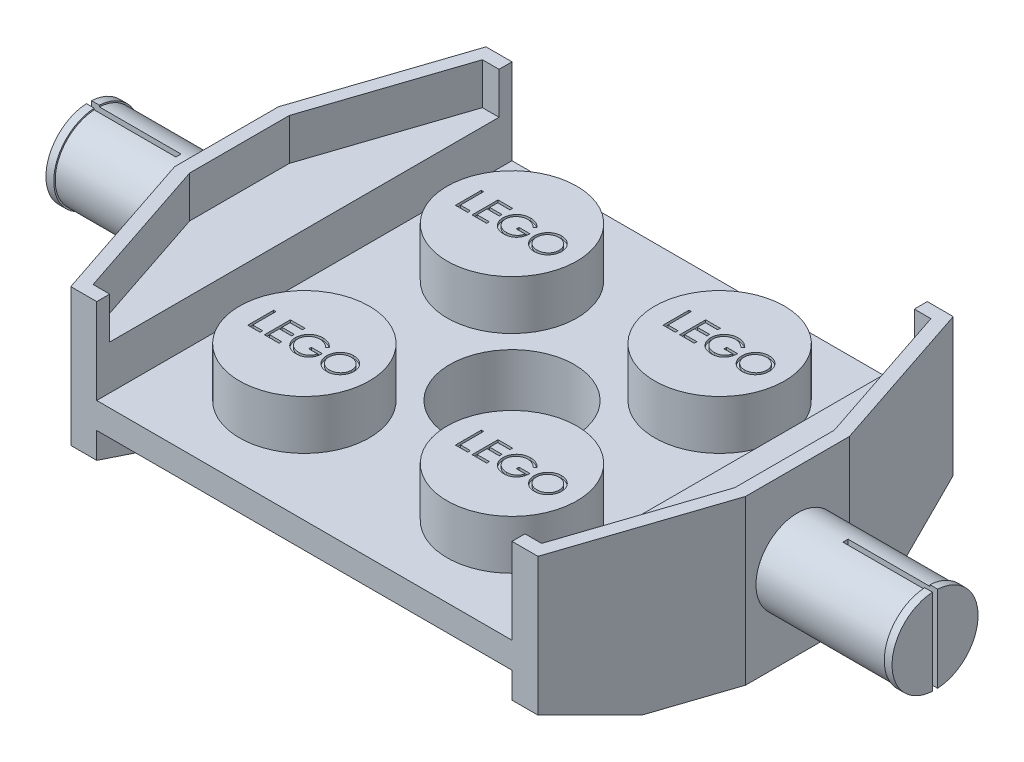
SolidWorks part; units mm, degrees
ref_plane "Plano frontal" through (0, 0, 0) normal (0, 0, 1) x (1, 0, 0)
ref_plane "Plano superior" through (0, 0, 0) normal (0, 1, 0) x (1, 0, 0)
ref_plane "Plano direito" through (0, 0, 0) normal (1, 0, 0) x (0, 0, -1)
sketch "Esboço1" plane through (0, 0, 0) normal (0, 1, 0) x (1, 0, 0)
  line L1 (0, 0) -> (16, 0)
  line L2 (0, 0) -> (0, 16)
  line L3 (0, 16) -> (16, 16)
  line L4 (16, 0) -> (16, 16)
  dimension "D1" = 16
  dimension "D2" = 16
extrude "Ressalto-extrusão1" add sketch "Esboço1" along normal blind 10
sketch "Esboço2" plane through (0, 10, 0) normal (0, 1, 0) x (1, 0, 0)
  line L0 (0, 0) -> (16, 0) construction
  line L1 (16, 0) -> (16, 16) construction
  circle A0 centre (4, 4) radius 2.5
  circle A1 centre (4, 12) radius 2.5
  circle A2 centre (12, 12) radius 2.5
  circle A3 centre (12, 4) radius 2.5
  dimension "D1" = 5
  dimension "D2" = 5
  dimension "D3" = 5
  dimension "D4" = 5
  dimension "D5" = 8
  dimension "D6" = 8
  dimension "D7" = 8
  dimension "D8" = 8
  dimension "D9" = 4
  dimension "D10" = 4
  dimension "D11" = 8
extrude "Ressalto-extrusão2" add sketch "Esboço2" along normal blind 1.9
sketch "Esboço3" plane through (0, 0, 0) normal (0, -1, 0) x (1, 0, 0)
  line L0 (0, 0) -> (16, 0) construction
  line L1 (1, -1) -> (15, -1)
  line L2 (1, -1) -> (1, -15)
  line L3 (1, -15) -> (15, -15)
  line L4 (15, -1) -> (15, -15)
  line L5 (16, -16) -> (0, -16) construction
  line L6 (16, 0) -> (16, -16) construction
  line L7 (0, -16) -> (0, 0) construction
  circle A0 centre (8, -8) radius 3.5
  circle A1 centre (8, -8) radius 2.5
  dimension "D5" = 7
  dimension "D6" = 5
  dimension "D1" = 1
  dimension "D2" = 1
  dimension "D3" = 1
  dimension "D4" = 1
extrude "Corte-extrusão1" cut sketch "Esboço3" against normal blind 9 contours L4 L1 L2 L3 A0 | A1
sketch "Esboço6" plane through (0, 11.9, 0) normal (0, 1, 0) x (1, 0, 0)
  text T0 "LEGO" font "Century Gothic" height 1
extrude "Corte-extrusão2" cut sketch "Esboço6" against normal blind 0.1
pattern_linear "Padrão linear1" count 2 spacing 8 along (0, 0, -1) of "Corte-extrusão2"
pattern_linear "Padrão linear2" count 2 spacing 8 along (1, 0, 0) of "Padrão linear1", "Corte-extrusão2"
pattern_linear "Padrão linear3" count 3 spacing 16 along (0, 0, -1) of "Ressalto-extrusão1", "Ressalto-extrusão2", "Corte-extrusão1", "Corte-extrusão2", "Padrão linear1", "Padrão linear2"
sketch "Esboço7" plane through (0, 0, 0) normal (0, -1, 0) x (1, 0, 0)
  line L1 (1, -15) -> (15, -15)
  line L2 (1, -15) -> (1, -17)
  line L3 (1, -17) -> (15, -17)
  line L4 (15, -15) -> (15, -17)
  line L5 (1, -31) -> (15, -31)
  line L6 (1, -31) -> (1, -33)
  line L7 (1, -33) -> (15, -33)
  line L8 (15, -31) -> (15, -33)
extrude "Corte-extrusão3" cut sketch "Esboço7" against normal up to surface (9 mm away)
sketch "Esboço8" plane through (16, 0, 0) normal (1, 0, 0) x (0, 0, -1)
  line L0 (48, 10) -> (48, 0) construction
  line L1 (0, 0) -> (48, 0)
  line L2 (0, 0) -> (0, 6.6666)
  line L3 (0, 6.6666) -> (48, 6.6666)
  line L4 (48, 0) -> (48, 6.6666)
  dimension "D1" = 6.6666
extrude "Corte-extrusão4" cut sketch "Esboço8" against normal blind 20
sketch "Esboço12" plane through (16, 0, 0) normal (1, 0, 0) x (0, 0, -1)
  line L0 (0, 10) -> (48, 10) construction
  line L1 (16, 10) -> (48, 10)
  line L2 (16, 10) -> (16, 6.6666)
  line L3 (16, 6.6666) -> (48, 6.6666)
  line L4 (48, 10) -> (48, 6.6666)
  line L5 (0, 10) -> (0, 6.6666) construction
  line L7 (16, 10) -> (48, 10)
  line L8 (16, 10) -> (16, 14.4178)
  line L9 (16, 14.4178) -> (48, 14.4178)
  line L10 (48, 10) -> (48, 14.4178)
  dimension "D1" = 16
extrude "Corte-extrusão7" cut sketch "Esboço12" against normal blind 20 contours L10 L9 L8 M6 | L2 M6 M4 M5
sketch "Esboço13" plane through (0, 9, 0) normal (0, -1, 0) x (1, 0, 0)
  line L0 (15, -1) -> (15, -16) construction
  line L1 (1, -16) -> (15, -16)
  line L2 (1, -16) -> (1, -15)
  line L3 (1, -15) -> (15, -15)
  line L4 (15, -16) -> (15, -15)
  dimension "D1" = 1
extrude "Ressalto-extrusão4" add sketch "Esboço13" along normal up to surface (2.3334 mm away)
sketch "Esboço14" plane through (0, 0, 0) normal (0, 0, 1) x (1, 0, 0)
  line L0 (0, 10) -> (16, 10) construction
  line L1 (16, 6.6666) -> (19, 6.6666)
  line L2 (16, 6.6666) -> (16, 13.3)
  line L3 (16, 13.3) -> (19, 13.3)
  line L4 (19, 6.6666) -> (19, 13.3)
  dimension "D1" = 3
  dimension "D2" = 3.3
extrude "Ressalto-extrusão5" add sketch "Esboço14" against normal up to surface (16 mm away)
sketch "Esboço15" plane through (0, 13.3, 0) normal (0, 1, 0) x (1, 0, 0)
  line L0 (17, 16) -> (19, 10)
  line L1 (19, 16) -> (16, 16) construction
  line L2 (19, 16) -> (19, 0) construction
  line L3 (19, 10) -> (19, 16)
  line L4 (19, 16) -> (17, 16)
  line L5 (17, 0) -> (19, 6)
  line L6 (19, 0) -> (16, 0) construction
  line L7 (19, 6) -> (19, 0)
  line L8 (19, 0) -> (17, 0)
  dimension "D1" = 6
  dimension "D2" = 1
  dimension "D3" = 1
  dimension "D4" = 6
extrude "Corte-extrusão8" cut sketch "Esboço15" against normal blind 10
sketch "Esboço17" plane through (0, 0, 0) normal (0, 0, 1) x (1, 0, 0)
  line L0 (0, 10) -> (0, 6.6666) construction
  line L1 (0, 9) -> (16, 9)
  line L2 (0, 9) -> (0, 6.6666)
  line L3 (0, 6.6666) -> (16, 6.6666)
  line L4 (16, 9) -> (16, 6.6666)
  line L5 (0, 6.6666) -> (17, 6.6666) construction
  dimension "D1" = 1
extrude "Corte-extrusão9" cut sketch "Esboço17" against normal blind 20
sketch "Esboço18" plane through (0, 0, 0) normal (0, 0, 1) x (1, 0, 0)
  line L0 (16, 9) -> (0, 9) construction
  line L1 (16, 6.6666) -> (23.2369, 6.6666)
  line L2 (16, 6.6666) -> (16, 7)
  line L3 (16, 7) -> (23.2369, 7)
  line L4 (23.2369, 6.6666) -> (23.2369, 7)
  dimension "D1" = 2
extrude "Corte-extrusão10" cut sketch "Esboço18" against normal blind 20
sketch "Esboço19" plane through (0, 13.3, 0) normal (0, 1, 0) x (1, 0, 0)
  line L10 (16.6396, 0.5) -> (16, 0.5)
  line L11 (18.5, 6.0811) -> (16.6396, 0.5)
  line L12 (18.5, 9.9189) -> (18.5, 6.0811)
  line L13 (16.6396, 15.5) -> (18.5, 9.9189)
  line L14 (16.6396, 15.5) -> (16, 15.5)
  line L15 (16, 15.5) -> (16, 0.5)
extrude "Corte-extrusão11" cut sketch "Esboço19" against normal blind 1.6
sketch "Esboço20" plane through (19, 0, 0) normal (1, 0, 0) x (0, 0, -1)
  circle A0 centre (8, 10.15) radius 1.6
  dimension "D1" = 3.2
extrude "Ressalto-extrusão6" add sketch "Esboço20" along normal blind 5 contours A0
ref_plane "Plano1" through (8, 0, 0) normal (-1, 0, 0) x (0, 0, 1)
mirror "Espelhar2" about plane through (8, 0, 0) normal (-1, 0, 0) of "Ressalto-extrusão5", "Corte-extrusão8", "Corte-extrusão9", "Corte-extrusão10", "Corte-extrusão11", "Ressalto-extrusão6"
sketch "Esboço23" plane through (24, 0, 0) normal (1, 0, 0) x (0, 0, -1)
  circle A0 centre (8, 10.15) radius 1.6573
extrude "Ressalto-extrusão8" add sketch "Esboço23" along normal blind 0.3
sketch "Esboço24" plane through (24.3, 0, 0) normal (1, 0, 0) x (0, 0, -1)
  line L1 (7.9007, 12.0925) -> (7.9007, 8.3096)
  line L2 (8.1007, 12.0925) -> (8.1007, 8.3096)
  line L3 (7.9007, 12.0925) -> (8.1007, 12.0925)
  line L4 (7.9007, 8.3096) -> (8.1007, 8.3096)
extrude "Corte-extrusão12" cut sketch "Esboço24" against normal blind 3.45
mirror "Espelhar4" about plane through (8, 0, 0) normal (-1, 0, 0) of "Ressalto-extrusão8", "Corte-extrusão12"
sketch "Esboço25" plane through (24.3, 0, 0) normal (1, 0, 0) x (0, 0, -1)
  line L0 (0, 7) -> (0, 8)
  line L1 (0, 7) -> (0, 13.3) construction
  line L2 (0, 8) -> (3, 7)
  line L3 (0, 7) -> (6, 7) construction
  line L4 (3, 7) -> (0, 7)
  line L5 (16, 7) -> (16, 8)
  line L6 (16, 7) -> (16, 13.3) construction
  line L7 (16, 8) -> (13, 7)
  line L8 (10, 7) -> (16, 7) construction
  line L9 (13, 7) -> (16, 7)
  dimension "D1" = 1
  dimension "D2" = 1
extrude "Corte-extrusão13" cut sketch "Esboço25" against normal blind 43.45
sketch "Esboço27" plane through (0, 9, 0) normal (0, -1, 0) x (1, 0, 0)
  line L0 (8, 11.2587) -> (8, -11.2587) construction
  circle A0 centre (8, -8) radius 2.4
  dimension "D1" = 4.8
extrude "Corte-extrusão14" cut sketch "Esboço27" against normal blind 10
sketch "Esboço28" plane through (0, 9, 0) normal (0, -1, 0) x (1, 0, 0)
  circle A0 centre (8, -8) radius 2.4
  circle A1 centre (8, -8) radius 2.9
  dimension "D1" = 4.8
  dimension "D2" = 0.5
extrude "Ressalto-extrusão9" add sketch "Esboço28" along normal blind 1.3
sketch "Esboço29" plane through (0, 9, 0) normal (0, -1, 0) x (1, 0, 0)
  line L0 (10.8521, -8.1) -> (16, -8.1)
  line L1 (5.1553, -7.9002) -> (5.1553, -8.1)
  line L3 (0, -8.1) -> (5.1553, -8.1)
  line L4 (0, -7.9) -> (5.1553, -7.9002)
  line L5 (16, -7.9006) -> (16, -8.1)
  line L6 (0, -7.9) -> (0, -8.1)
  line L7 (10.8521, -7.9004) -> (16, -7.9006)
  line L8 (10.8521, -7.9004) -> (10.8521, -8.1)
extrude "Ressalto-extrusão10" add sketch "Esboço29" along normal blind 1.3
sketch "Esboço30" plane through (0, 9, 0) normal (0, -1, 0) x (1, 0, 0)
  circle A0 centre (4, -4) radius 1.25
  circle A1 centre (12, -4) radius 1.25
  circle A2 centre (12, -12) radius 1.25
  circle A3 centre (4, -12) radius 1.25
  dimension "D1" = 2.5
  dimension "D2" = 2.5
  dimension "D3" = 2.5
  dimension "D4" = 2.5
extrude "Corte-extrusão15" cut sketch "Esboço30" against normal blind 0.3
sketch "Esboço31" plane through (0, 7, 0) normal (0, -1, 0) x (1, 0, 0)
  line L32 (-2.6, -6.0649) -> (-2.6, -9.9351)
  line L33 (-1.6205, -12.8735) -> (-2.6, -9.9351)
  line L34 (-1.6205, -12.8735) -> (-0.7117, -15.6)
  line L35 (-0.7117, -15.6) -> (-0.4, -15.6)
  line L36 (-0.4, -0.4) -> (-0.4, -15.6)
  line L37 (-0.7117, -0.4) -> (-0.4, -0.4)
  line L38 (-0.7117, -0.4) -> (-1.6205, -3.1265)
  line L39 (-2.6, -6.0649) -> (-1.6205, -3.1265)
  line L40 (18.6, -9.9351) -> (18.6, -6.0649)
  line L41 (17.6205, -3.1265) -> (18.6, -6.0649)
  line L42 (16.7117, -0.4) -> (17.6205, -3.1265)
  line L43 (16.4, -0.4) -> (16.7117, -0.4)
  line L44 (16.4, -15.6) -> (16.4, -0.4)
  line L45 (16.4, -15.6) -> (16.7117, -15.6)
  line L46 (17.6205, -12.8735) -> (16.7117, -15.6)
  line L47 (18.6, -9.9351) -> (17.6205, -12.8735)
extrude "Corte-extrusão16" cut sketch "Esboço31" against normal blind 1.7
